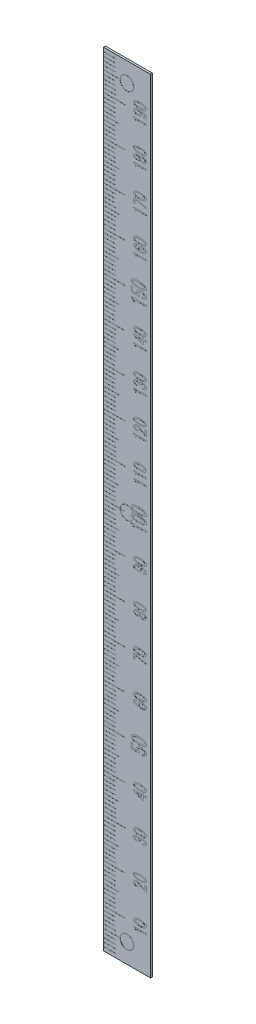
SolidWorks part; units mm, degrees
ref_plane "Front" through (0, 0, 0) normal (0, 0, 1) x (1, 0, 0)
ref_plane "Top" through (0, 0, 0) normal (0, 1, 0) x (1, 0, 0)
ref_plane "Right" through (0, 0, 0) normal (1, 0, 0) x (0, 0, -1)
sketch "Sketch1" plane through (0, 0, 0) normal (0, 0, 1) x (1, 0, 0)
  line L1 (0, 0) -> (0, 200)
  line L2 (0, 0) -> (12, 0)
  line L3 (12, 0) -> (12, 200)
  line L4 (0, 200) -> (12, 200)
  dimension "D1" = 200
  dimension "D2" = 12
extrude "Extrude1" add sketch "Sketch1" along normal blind 0.5
sketch "Sketch2" plane through (0, 0, 0.5) normal (0, 0, 1) x (1, 0, 0)
  line L0 (0, 200) -> (0, 0) construction
  line L1 (0, 0) -> (12, 0) construction
  line L2 (12, 200) -> (0, 200) construction
  circle A0 centre (6, 5) radius 1.75
  circle A1 centre (6, 195) radius 1.75
  circle A2 centre (6, 5) radius 1.65
  circle A3 centre (6, 195) radius 1.65
  circle A4 centre (6, 100) radius 1.75
  circle A5 centre (6, 100) radius 1.65
  dimension "D1" = 6
  dimension "D2" = 6
  dimension "D3" = 5
  dimension "D4" = 5
  dimension "D5" = 3.5
  dimension "D6" = 3.5
  dimension "D7" = 0.1
  dimension "D8" = 2
extrude "Extrude2" cut sketch "Sketch2" against normal blind 0.01
sketch "Sketch3" plane through (0, 0, 0.5) normal (0, 0, 1) x (1, 0, 0)
  line L0 (7.5, 187.4) -> (11, 187.4) construction
  line L1 (7.5, 137.4) -> (11, 137.4) construction
  line L2 (7.5, 137.4) -> (7.5, 140.9) construction
  line L3 (7.5, 140.9) -> (11, 140.9) construction
  line L4 (11, 137.4) -> (11, 140.9) construction
  line L6 (11, 127.4) -> (11, 130.9) construction
  line L7 (11, 117.4) -> (11, 120.9) construction
  line L8 (11, 107.4) -> (11, 110.9) construction
  line L9 (11, 97.2) -> (11, 102.8) construction
  line L10 (11, 88.25) -> (11, 91.75) construction
  line L11 (11, 78.25) -> (11, 81.75) construction
  line L12 (11, 68.25) -> (11, 71.75) construction
  line L13 (11, 58.25) -> (11, 61.75) construction
  line L14 (11, 48) -> (11, 52) construction
  line L15 (11, 38.25) -> (11, 43.5) construction
  line L16 (11, 110) -> (-4.9003, 110) construction
  line L17 (11, 50) -> (-4.9003, 50) construction
  line L18 (11, 28.25) -> (11, 33.5) construction
  line L19 (11, 18.25) -> (11, 23.5) construction
  line L20 (11, 8.25) -> (11, 13.5) construction
  line L21 (11, 100) -> (-4.9003, 100) construction
  line L22 (11, 120) -> (-4.9003, 120) construction
  line L23 (11, 130) -> (-4.9003, 130) construction
  line L24 (11, 140) -> (-4.9003, 140) construction
  line L25 (7.5, 187.4) -> (7.5, 190.9) construction
  line L26 (7.5, 190.9) -> (11, 190.9) construction
  line L27 (11, 187.4) -> (11, 190.9) construction
  line L28 (11, 177.4) -> (11, 180.9) construction
  line L29 (11, 167.4) -> (11, 170.9) construction
  line L30 (11, 157.4) -> (11, 160.9) construction
  line L31 (11, 147.2) -> (11, 152.8) construction
  line L32 (11, 160) -> (-4.9003, 160) construction
  line L33 (11, 150) -> (-4.9003, 150) construction
  line L34 (11, 170) -> (-4.9003, 170) construction
  line L35 (11, 180) -> (-4.9003, 180) construction
  line L36 (11, 190) -> (-4.9003, 190) construction
  line L37 (11, 40) -> (-4.9003, 40) construction
  line L38 (11, 30) -> (-4.9003, 30) construction
  line L39 (11, 20) -> (-4.9003, 20) construction
  line L40 (11, 10) -> (-4.9003, 10) construction
  line L41 (12, 0) -> (12, 200) construction
  text T0 "140" font "ＭＳ ゴシック" height in points 11
  text T1 "130" font "ＭＳ ゴシック" height in points 11
  text T2 "120" font "ＭＳ ゴシック" height in points 11
  text T3 "110" font "ＭＳ ゴシック" height in points 11
  text T4 "100" font "ＭＳ ゴシック" height in points 13
  text T5 "90" font "ＭＳ ゴシック" height in points 11
  text T6 "80" font "ＭＳ ゴシック" height in points 11
  text T7 "70" font "ＭＳ ゴシック" height in points 11
  text T8 "60" font "ＭＳ ゴシック" height in points 11
  text T9 "50" font "ＭＳ ゴシック" height in points 13
  text T10 "40" font "ＭＳ ゴシック" height in points 11
  text T11 "30" font "ＭＳ ゴシック" height in points 11
  text T12 "20" font "ＭＳ ゴシック" height in points 11
  text T13 "10" font "ＭＳ ゴシック" height in points 11
  text T14 "150" font "ＭＳ ゴシック" height in points 13
  text T15 "160" font "ＭＳ ゴシック" height in points 11
  text T16 "170" font "ＭＳ ゴシック" height in points 11
  text T17 "180" font "ＭＳ ゴシック" height in points 11
  text T18 "190" font "ＭＳ ゴシック" height in points 11
  point P19 (11, 100)
  dimension "D1" = 3.5
  dimension "D2" = 2.6
  dimension "D3" = 1
  dimension "D4" = 3.5
  dimension "D8" = 4
  dimension "D9" = 50
  dimension "D10" = 2
  dimension "D11" = 5.6
  dimension "D12" = 2.6
  dimension "D5" = 3.5
  dimension "D13" = 2.6
  dimension "D14" = 2.6
  dimension "D15" = 2
  dimension "D16" = 1.75
  dimension "D17" = 1.75
  dimension "D18" = 1.75
  dimension "D19" = 1.75
  dimension "D6" = 5
  dimension "D7" = 5
extrude "Extrude3" cut sketch "Sketch3" against normal blind 0.01
sketch "Sketch4" plane through (0, 0, 0.5) normal (0, 0, 1) x (1, 0, 0)
  line L5 (12, 200) -> (0, 200) construction
  line L806 (6, 200) -> (6, 0) construction
  line L807 (0, 0) -> (12, 0) construction
  line L808 (3, 1.05) -> (3, 0.95)
  line L809 (0, 0.95) -> (3, 0.95)
  line L810 (0, 1.05) -> (3, 1.05)
  line L811 (0, 1.05) -> (0, 0.95)
  line L812 (3, 2.05) -> (3, 1.95)
  line L813 (0, 1.95) -> (3, 1.95)
  line L814 (0, 2.05) -> (3, 2.05)
  line L815 (0, 2.05) -> (0, 1.95)
  line L816 (3, 3.05) -> (3, 2.95)
  line L817 (0, 2.95) -> (3, 2.95)
  line L818 (0, 3.05) -> (3, 3.05)
  line L819 (0, 3.05) -> (0, 2.95)
  line L820 (3, 4.05) -> (3, 3.95)
  line L821 (0, 3.95) -> (3, 3.95)
  line L822 (0, 4.05) -> (3, 4.05)
  line L823 (0, 4.05) -> (0, 3.95)
  line L824 (3, 6.05) -> (3, 5.95)
  line L825 (0, 5.95) -> (3, 5.95)
  line L826 (0, 6.05) -> (3, 6.05)
  line L827 (0, 6.05) -> (0, 5.95)
  line L828 (3, 7.05) -> (3, 6.95)
  line L829 (0, 6.95) -> (3, 6.95)
  line L830 (0, 7.05) -> (3, 7.05)
  line L831 (0, 7.05) -> (0, 6.95)
  line L832 (3, 8.05) -> (3, 7.95)
  line L833 (0, 7.95) -> (3, 7.95)
  line L834 (0, 8.05) -> (3, 8.05)
  line L835 (3, 9.05) -> (3, 8.95)
  line L836 (0, 8.95) -> (3, 8.95)
  line L837 (0, 9.05) -> (0, 8.95)
  line L838 (0, 9.05) -> (3, 9.05)
  line L839 (4, 4.95) -> (4, 5.05)
  line L840 (0, 5.05) -> (4, 5.05)
  line L841 (0, 4.95) -> (0, 5.05)
  line L842 (0, 4.95) -> (4, 4.95)
  line L843 (0, 8.05) -> (0, 7.95)
  line L844 (0, 9.95) -> (0, 10.05)
  line L845 (5.5, 9.95) -> (0, 9.95)
  line L846 (5.5, 10.05) -> (5.5, 9.95)
  line L847 (0, 10.05) -> (5.5, 10.05)
  line L848 (3, 11.05) -> (3, 10.95)
  line L849 (0, 10.95) -> (3, 10.95)
  line L850 (0, 11.05) -> (3, 11.05)
  line L851 (0, 11.05) -> (0, 10.95)
  line L852 (3, 12.05) -> (3, 11.95)
  line L853 (0, 11.95) -> (3, 11.95)
  line L854 (0, 12.05) -> (3, 12.05)
  line L855 (0, 12.05) -> (0, 11.95)
  line L856 (3, 13.05) -> (3, 12.95)
  line L857 (0, 12.95) -> (3, 12.95)
  line L858 (0, 13.05) -> (3, 13.05)
  line L859 (0, 13.05) -> (0, 12.95)
  line L860 (3, 14.05) -> (3, 13.95)
  line L861 (0, 13.95) -> (3, 13.95)
  line L862 (0, 14.05) -> (3, 14.05)
  line L863 (0, 14.05) -> (0, 13.95)
  line L864 (3, 16.05) -> (3, 15.95)
  line L865 (0, 15.95) -> (3, 15.95)
  line L866 (0, 16.05) -> (3, 16.05)
  line L867 (0, 16.05) -> (0, 15.95)
  line L868 (3, 17.05) -> (3, 16.95)
  line L869 (0, 16.95) -> (3, 16.95)
  line L870 (0, 17.05) -> (3, 17.05)
  line L871 (0, 17.05) -> (0, 16.95)
  line L872 (3, 18.05) -> (3, 17.95)
  line L873 (0, 17.95) -> (3, 17.95)
  line L874 (0, 18.05) -> (3, 18.05)
  line L875 (3, 19.05) -> (3, 18.95)
  line L876 (0, 18.95) -> (3, 18.95)
  line L877 (0, 19.05) -> (0, 18.95)
  line L878 (0, 19.05) -> (3, 19.05)
  line L879 (4, 14.95) -> (4, 15.05)
  line L880 (0, 15.05) -> (4, 15.05)
  line L881 (0, 14.95) -> (0, 15.05)
  line L882 (0, 14.95) -> (4, 14.95)
  line L883 (0, 18.05) -> (0, 17.95)
  line L884 (0, 19.95) -> (0, 20.05)
  line L885 (5.5, 19.95) -> (0, 19.95)
  line L886 (5.5, 20.05) -> (5.5, 19.95)
  line L887 (0, 20.05) -> (5.5, 20.05)
  line L888 (3, 21.05) -> (3, 20.95)
  line L889 (0, 20.95) -> (3, 20.95)
  line L890 (0, 21.05) -> (3, 21.05)
  line L891 (0, 21.05) -> (0, 20.95)
  line L892 (3, 22.05) -> (3, 21.95)
  line L893 (0, 21.95) -> (3, 21.95)
  line L894 (0, 22.05) -> (3, 22.05)
  line L895 (0, 22.05) -> (0, 21.95)
  line L896 (3, 23.05) -> (3, 22.95)
  line L897 (0, 22.95) -> (3, 22.95)
  line L898 (0, 23.05) -> (3, 23.05)
  line L899 (0, 23.05) -> (0, 22.95)
  line L900 (3, 24.05) -> (3, 23.95)
  line L901 (0, 23.95) -> (3, 23.95)
  line L902 (0, 24.05) -> (3, 24.05)
  line L903 (0, 24.05) -> (0, 23.95)
  line L904 (3, 26.05) -> (3, 25.95)
  line L905 (0, 25.95) -> (3, 25.95)
  line L906 (0, 26.05) -> (3, 26.05)
  line L907 (0, 26.05) -> (0, 25.95)
  line L908 (3, 27.05) -> (3, 26.95)
  line L909 (0, 26.95) -> (3, 26.95)
  line L910 (0, 27.05) -> (3, 27.05)
  line L911 (0, 27.05) -> (0, 26.95)
  line L912 (3, 28.05) -> (3, 27.95)
  line L913 (0, 27.95) -> (3, 27.95)
  line L914 (0, 28.05) -> (3, 28.05)
  line L915 (3, 29.05) -> (3, 28.95)
  line L916 (0, 28.95) -> (3, 28.95)
  line L917 (0, 29.05) -> (0, 28.95)
  line L918 (0, 29.05) -> (3, 29.05)
  line L919 (4, 24.95) -> (4, 25.05)
  line L920 (0, 25.05) -> (4, 25.05)
  line L921 (0, 24.95) -> (0, 25.05)
  line L922 (0, 24.95) -> (4, 24.95)
  line L923 (0, 28.05) -> (0, 27.95)
  line L924 (0, 29.95) -> (0, 30.05)
  line L925 (5.5, 29.95) -> (0, 29.95)
  line L926 (5.5, 30.05) -> (5.5, 29.95)
  line L927 (0, 30.05) -> (5.5, 30.05)
  line L928 (3, 31.05) -> (3, 30.95)
  line L929 (0, 30.95) -> (3, 30.95)
  line L930 (0, 31.05) -> (3, 31.05)
  line L931 (0, 31.05) -> (0, 30.95)
  line L932 (3, 32.05) -> (3, 31.95)
  line L933 (0, 31.95) -> (3, 31.95)
  line L934 (0, 32.05) -> (3, 32.05)
  line L935 (0, 32.05) -> (0, 31.95)
  line L936 (3, 33.05) -> (3, 32.95)
  line L937 (0, 32.95) -> (3, 32.95)
  line L938 (0, 33.05) -> (3, 33.05)
  line L939 (0, 33.05) -> (0, 32.95)
  line L940 (3, 34.05) -> (3, 33.95)
  line L941 (0, 33.95) -> (3, 33.95)
  line L942 (0, 34.05) -> (3, 34.05)
  line L943 (0, 34.05) -> (0, 33.95)
  line L944 (3, 36.05) -> (3, 35.95)
  line L945 (0, 35.95) -> (3, 35.95)
  line L946 (0, 36.05) -> (3, 36.05)
  line L947 (0, 36.05) -> (0, 35.95)
  line L948 (3, 37.05) -> (3, 36.95)
  line L949 (0, 36.95) -> (3, 36.95)
  line L950 (0, 37.05) -> (3, 37.05)
  line L951 (0, 37.05) -> (0, 36.95)
  line L952 (3, 38.05) -> (3, 37.95)
  line L953 (0, 37.95) -> (3, 37.95)
  line L954 (0, 38.05) -> (3, 38.05)
  line L955 (3, 39.05) -> (3, 38.95)
  line L956 (0, 38.95) -> (3, 38.95)
  line L957 (0, 39.05) -> (0, 38.95)
  line L958 (0, 39.05) -> (3, 39.05)
  line L959 (4, 34.95) -> (4, 35.05)
  line L960 (0, 35.05) -> (4, 35.05)
  line L961 (0, 34.95) -> (0, 35.05)
  line L962 (0, 34.95) -> (4, 34.95)
  line L963 (0, 38.05) -> (0, 37.95)
  line L964 (0, 39.95) -> (0, 40.05)
  line L965 (5.5, 39.95) -> (0, 39.95)
  line L966 (5.5, 40.05) -> (5.5, 39.95)
  line L967 (0, 40.05) -> (5.5, 40.05)
  line L968 (3, 41.05) -> (3, 40.95)
  line L969 (0, 40.95) -> (3, 40.95)
  line L970 (0, 41.05) -> (3, 41.05)
  line L971 (0, 41.05) -> (0, 40.95)
  line L972 (3, 42.05) -> (3, 41.95)
  line L973 (0, 41.95) -> (3, 41.95)
  line L974 (0, 42.05) -> (3, 42.05)
  line L975 (0, 42.05) -> (0, 41.95)
  line L976 (3, 43.05) -> (3, 42.95)
  line L977 (0, 42.95) -> (3, 42.95)
  line L978 (0, 43.05) -> (3, 43.05)
  line L979 (0, 43.05) -> (0, 42.95)
  line L980 (3, 44.05) -> (3, 43.95)
  line L981 (0, 43.95) -> (3, 43.95)
  line L982 (0, 44.05) -> (3, 44.05)
  line L983 (0, 44.05) -> (0, 43.95)
  line L984 (3, 46.05) -> (3, 45.95)
  line L985 (0, 45.95) -> (3, 45.95)
  line L986 (0, 46.05) -> (3, 46.05)
  line L987 (0, 46.05) -> (0, 45.95)
  line L988 (3, 47.05) -> (3, 46.95)
  line L989 (0, 46.95) -> (3, 46.95)
  line L990 (0, 47.05) -> (3, 47.05)
  line L991 (0, 47.05) -> (0, 46.95)
  line L992 (3, 48.05) -> (3, 47.95)
  line L993 (0, 47.95) -> (3, 47.95)
  line L994 (0, 48.05) -> (3, 48.05)
  line L995 (3, 49.05) -> (3, 48.95)
  line L996 (0, 48.95) -> (3, 48.95)
  line L997 (0, 49.05) -> (0, 48.95)
  line L998 (0, 49.05) -> (3, 49.05)
  line L999 (4, 44.95) -> (4, 45.05)
  line L1000 (0, 45.05) -> (4, 45.05)
  line L1001 (0, 44.95) -> (0, 45.05)
  line L1002 (0, 44.95) -> (4, 44.95)
  line L1003 (0, 48.05) -> (0, 47.95)
  line L1004 (0, 49.95) -> (0, 50.05)
  line L1005 (5.5, 49.95) -> (0, 49.95)
  line L1006 (5.5, 50.05) -> (5.5, 49.95)
  line L1007 (0, 50.05) -> (5.5, 50.05)
  line L1008 (3, 51.05) -> (3, 50.95)
  line L1009 (0, 50.95) -> (3, 50.95)
  line L1010 (0, 51.05) -> (3, 51.05)
  line L1011 (0, 51.05) -> (0, 50.95)
  line L1012 (3, 52.05) -> (3, 51.95)
  line L1013 (0, 51.95) -> (3, 51.95)
  line L1014 (0, 52.05) -> (3, 52.05)
  line L1015 (0, 52.05) -> (0, 51.95)
  line L1016 (3, 53.05) -> (3, 52.95)
  line L1017 (0, 52.95) -> (3, 52.95)
  line L1018 (0, 53.05) -> (3, 53.05)
  line L1019 (0, 53.05) -> (0, 52.95)
  line L1020 (3, 54.05) -> (3, 53.95)
  line L1021 (0, 53.95) -> (3, 53.95)
  line L1022 (0, 54.05) -> (3, 54.05)
  line L1023 (0, 54.05) -> (0, 53.95)
  line L1024 (3, 56.05) -> (3, 55.95)
  line L1025 (0, 55.95) -> (3, 55.95)
  line L1026 (0, 56.05) -> (3, 56.05)
  line L1027 (0, 56.05) -> (0, 55.95)
  line L1028 (3, 57.05) -> (3, 56.95)
  line L1029 (0, 56.95) -> (3, 56.95)
  line L1030 (0, 57.05) -> (3, 57.05)
  line L1031 (0, 57.05) -> (0, 56.95)
  line L1032 (3, 58.05) -> (3, 57.95)
  line L1033 (0, 57.95) -> (3, 57.95)
  line L1034 (0, 58.05) -> (3, 58.05)
  line L1035 (3, 59.05) -> (3, 58.95)
  line L1036 (0, 58.95) -> (3, 58.95)
  line L1037 (0, 59.05) -> (0, 58.95)
  line L1038 (0, 59.05) -> (3, 59.05)
  line L1039 (4, 54.95) -> (4, 55.05)
  line L1040 (0, 55.05) -> (4, 55.05)
  line L1041 (0, 54.95) -> (0, 55.05)
  line L1042 (0, 54.95) -> (4, 54.95)
  line L1043 (0, 58.05) -> (0, 57.95)
  line L1044 (0, 59.95) -> (0, 60.05)
  line L1045 (5.5, 59.95) -> (0, 59.95)
  line L1046 (5.5, 60.05) -> (5.5, 59.95)
  line L1047 (0, 60.05) -> (5.5, 60.05)
  line L1048 (3, 61.05) -> (3, 60.95)
  line L1049 (0, 60.95) -> (3, 60.95)
  line L1050 (0, 61.05) -> (3, 61.05)
  line L1051 (0, 61.05) -> (0, 60.95)
  line L1052 (3, 62.05) -> (3, 61.95)
  line L1053 (0, 61.95) -> (3, 61.95)
  line L1054 (0, 62.05) -> (3, 62.05)
  line L1055 (0, 62.05) -> (0, 61.95)
  line L1056 (3, 63.05) -> (3, 62.95)
  line L1057 (0, 62.95) -> (3, 62.95)
  line L1058 (0, 63.05) -> (3, 63.05)
  line L1059 (0, 63.05) -> (0, 62.95)
  line L1060 (3, 64.05) -> (3, 63.95)
  line L1061 (0, 63.95) -> (3, 63.95)
  line L1062 (0, 64.05) -> (3, 64.05)
  line L1063 (0, 64.05) -> (0, 63.95)
  line L1064 (3, 66.05) -> (3, 65.95)
  line L1065 (0, 65.95) -> (3, 65.95)
  line L1066 (0, 66.05) -> (3, 66.05)
  line L1067 (0, 66.05) -> (0, 65.95)
  line L1068 (3, 67.05) -> (3, 66.95)
  line L1069 (0, 66.95) -> (3, 66.95)
  line L1070 (0, 67.05) -> (3, 67.05)
  line L1071 (0, 67.05) -> (0, 66.95)
  line L1072 (3, 68.05) -> (3, 67.95)
  line L1073 (0, 67.95) -> (3, 67.95)
  line L1074 (0, 68.05) -> (3, 68.05)
  line L1075 (3, 69.05) -> (3, 68.95)
  line L1076 (0, 68.95) -> (3, 68.95)
  line L1077 (0, 69.05) -> (0, 68.95)
  line L1078 (0, 69.05) -> (3, 69.05)
  line L1079 (4, 64.95) -> (4, 65.05)
  line L1080 (0, 65.05) -> (4, 65.05)
  line L1081 (0, 64.95) -> (0, 65.05)
  line L1082 (0, 64.95) -> (4, 64.95)
  line L1083 (0, 68.05) -> (0, 67.95)
  line L1084 (0, 69.95) -> (0, 70.05)
  line L1085 (5.5, 69.95) -> (0, 69.95)
  line L1086 (5.5, 70.05) -> (5.5, 69.95)
  line L1087 (0, 70.05) -> (5.5, 70.05)
  line L1088 (3, 71.05) -> (3, 70.95)
  line L1089 (0, 70.95) -> (3, 70.95)
  line L1090 (0, 71.05) -> (3, 71.05)
  line L1091 (0, 71.05) -> (0, 70.95)
  line L1092 (3, 72.05) -> (3, 71.95)
  line L1093 (0, 71.95) -> (3, 71.95)
  line L1094 (0, 72.05) -> (3, 72.05)
  line L1095 (0, 72.05) -> (0, 71.95)
  line L1096 (3, 73.05) -> (3, 72.95)
  line L1097 (0, 72.95) -> (3, 72.95)
  line L1098 (0, 73.05) -> (3, 73.05)
  line L1099 (0, 73.05) -> (0, 72.95)
  line L1100 (3, 74.05) -> (3, 73.95)
  line L1101 (0, 73.95) -> (3, 73.95)
  line L1102 (0, 74.05) -> (3, 74.05)
  line L1103 (0, 74.05) -> (0, 73.95)
  line L1104 (3, 76.05) -> (3, 75.95)
  line L1105 (0, 75.95) -> (3, 75.95)
  line L1106 (0, 76.05) -> (3, 76.05)
  line L1107 (0, 76.05) -> (0, 75.95)
  line L1108 (3, 77.05) -> (3, 76.95)
  line L1109 (0, 76.95) -> (3, 76.95)
  line L1110 (0, 77.05) -> (3, 77.05)
  line L1111 (0, 77.05) -> (0, 76.95)
  line L1112 (3, 78.05) -> (3, 77.95)
  line L1113 (0, 77.95) -> (3, 77.95)
  line L1114 (0, 78.05) -> (3, 78.05)
  line L1115 (3, 79.05) -> (3, 78.95)
  line L1116 (0, 78.95) -> (3, 78.95)
  line L1117 (0, 79.05) -> (0, 78.95)
  line L1118 (0, 79.05) -> (3, 79.05)
  line L1119 (4, 74.95) -> (4, 75.05)
  line L1120 (0, 75.05) -> (4, 75.05)
  line L1121 (0, 74.95) -> (0, 75.05)
  line L1122 (0, 74.95) -> (4, 74.95)
  line L1123 (0, 78.05) -> (0, 77.95)
  line L1124 (0, 79.95) -> (0, 80.05)
  line L1125 (5.5, 79.95) -> (0, 79.95)
  line L1126 (5.5, 80.05) -> (5.5, 79.95)
  line L1127 (0, 80.05) -> (5.5, 80.05)
  line L1128 (3, 81.05) -> (3, 80.95)
  line L1129 (0, 80.95) -> (3, 80.95)
  line L1130 (0, 81.05) -> (3, 81.05)
  line L1131 (0, 81.05) -> (0, 80.95)
  line L1132 (3, 82.05) -> (3, 81.95)
  line L1133 (0, 81.95) -> (3, 81.95)
  line L1134 (0, 82.05) -> (3, 82.05)
  line L1135 (0, 82.05) -> (0, 81.95)
  line L1136 (3, 83.05) -> (3, 82.95)
  line L1137 (0, 82.95) -> (3, 82.95)
  line L1138 (0, 83.05) -> (3, 83.05)
  line L1139 (0, 83.05) -> (0, 82.95)
  line L1140 (3, 84.05) -> (3, 83.95)
  line L1141 (0, 83.95) -> (3, 83.95)
  line L1142 (0, 84.05) -> (3, 84.05)
  line L1143 (0, 84.05) -> (0, 83.95)
  line L1144 (3, 86.05) -> (3, 85.95)
  line L1145 (0, 85.95) -> (3, 85.95)
  line L1146 (0, 86.05) -> (3, 86.05)
  line L1147 (0, 86.05) -> (0, 85.95)
  line L1148 (3, 87.05) -> (3, 86.95)
  line L1149 (0, 86.95) -> (3, 86.95)
  line L1150 (0, 87.05) -> (3, 87.05)
  line L1151 (0, 87.05) -> (0, 86.95)
  line L1152 (3, 88.05) -> (3, 87.95)
  line L1153 (0, 87.95) -> (3, 87.95)
  line L1154 (0, 88.05) -> (3, 88.05)
  line L1155 (3, 89.05) -> (3, 88.95)
  line L1156 (0, 88.95) -> (3, 88.95)
  line L1157 (0, 89.05) -> (0, 88.95)
  line L1158 (0, 89.05) -> (3, 89.05)
  line L1159 (4, 84.95) -> (4, 85.05)
  line L1160 (0, 85.05) -> (4, 85.05)
  line L1161 (0, 84.95) -> (0, 85.05)
  line L1162 (0, 84.95) -> (4, 84.95)
  line L1163 (0, 88.05) -> (0, 87.95)
  line L1164 (0, 89.95) -> (0, 90.05)
  line L1165 (5.5, 89.95) -> (0, 89.95)
  line L1166 (5.5, 90.05) -> (5.5, 89.95)
  line L1167 (0, 90.05) -> (5.5, 90.05)
  line L1168 (3, 91.05) -> (3, 90.95)
  line L1169 (0, 90.95) -> (3, 90.95)
  line L1170 (0, 91.05) -> (3, 91.05)
  line L1171 (0, 91.05) -> (0, 90.95)
  line L1172 (3, 92.05) -> (3, 91.95)
  line L1173 (0, 91.95) -> (3, 91.95)
  line L1174 (0, 92.05) -> (3, 92.05)
  line L1175 (0, 92.05) -> (0, 91.95)
  line L1176 (3, 93.05) -> (3, 92.95)
  line L1177 (0, 92.95) -> (3, 92.95)
  line L1178 (0, 93.05) -> (3, 93.05)
  line L1179 (0, 93.05) -> (0, 92.95)
  line L1180 (3, 94.05) -> (3, 93.95)
  line L1181 (0, 93.95) -> (3, 93.95)
  line L1182 (0, 94.05) -> (3, 94.05)
  line L1183 (0, 94.05) -> (0, 93.95)
  line L1184 (3, 96.05) -> (3, 95.95)
  line L1185 (0, 95.95) -> (3, 95.95)
  line L1186 (0, 96.05) -> (3, 96.05)
  line L1187 (0, 96.05) -> (0, 95.95)
  line L1188 (3, 97.05) -> (3, 96.95)
  line L1189 (0, 96.95) -> (3, 96.95)
  line L1190 (0, 97.05) -> (3, 97.05)
  line L1191 (0, 97.05) -> (0, 96.95)
  line L1192 (3, 98.05) -> (3, 97.95)
  line L1193 (0, 97.95) -> (3, 97.95)
  line L1194 (0, 98.05) -> (3, 98.05)
  line L1195 (3, 99.05) -> (3, 98.95)
  line L1196 (0, 98.95) -> (3, 98.95)
  line L1197 (0, 99.05) -> (0, 98.95)
  line L1198 (0, 99.05) -> (3, 99.05)
  line L1199 (4, 94.95) -> (4, 95.05)
  line L1200 (0, 95.05) -> (4, 95.05)
  line L1201 (0, 94.95) -> (0, 95.05)
  line L1202 (0, 94.95) -> (4, 94.95)
  line L1203 (0, 98.05) -> (0, 97.95)
  line L1204 (0, 99.95) -> (0, 100.05)
  line L1205 (5.5, 99.95) -> (0, 99.95)
  line L1206 (5.5, 100.05) -> (5.5, 99.95)
  line L1207 (0, 100.05) -> (5.5, 100.05)
  line L1208 (3, 101.05) -> (3, 100.95)
  line L1209 (0, 100.95) -> (3, 100.95)
  line L1210 (0, 101.05) -> (3, 101.05)
  line L1211 (0, 101.05) -> (0, 100.95)
  line L1212 (3, 102.05) -> (3, 101.95)
  line L1213 (0, 101.95) -> (3, 101.95)
  line L1214 (0, 102.05) -> (3, 102.05)
  line L1215 (0, 102.05) -> (0, 101.95)
  line L1216 (3, 103.05) -> (3, 102.95)
  line L1217 (0, 102.95) -> (3, 102.95)
  line L1218 (0, 103.05) -> (3, 103.05)
  line L1219 (0, 103.05) -> (0, 102.95)
  line L1220 (3, 104.05) -> (3, 103.95)
  line L1221 (0, 103.95) -> (3, 103.95)
  line L1222 (0, 104.05) -> (3, 104.05)
  line L1223 (0, 104.05) -> (0, 103.95)
  line L1224 (3, 106.05) -> (3, 105.95)
  line L1225 (0, 105.95) -> (3, 105.95)
  line L1226 (0, 106.05) -> (3, 106.05)
  line L1227 (0, 106.05) -> (0, 105.95)
  line L1228 (3, 107.05) -> (3, 106.95)
  line L1229 (0, 106.95) -> (3, 106.95)
  line L1230 (0, 107.05) -> (3, 107.05)
  line L1231 (0, 107.05) -> (0, 106.95)
  line L1232 (3, 108.05) -> (3, 107.95)
  line L1233 (0, 107.95) -> (3, 107.95)
  line L1234 (0, 108.05) -> (3, 108.05)
  line L1235 (3, 109.05) -> (3, 108.95)
  line L1236 (0, 108.95) -> (3, 108.95)
  line L1237 (0, 109.05) -> (0, 108.95)
  line L1238 (0, 109.05) -> (3, 109.05)
  line L1239 (4, 104.95) -> (4, 105.05)
  line L1240 (0, 105.05) -> (4, 105.05)
  line L1241 (0, 104.95) -> (0, 105.05)
  line L1242 (0, 104.95) -> (4, 104.95)
  line L1243 (0, 108.05) -> (0, 107.95)
  line L1244 (0, 109.95) -> (0, 110.05)
  line L1245 (5.5, 109.95) -> (0, 109.95)
  line L1246 (5.5, 110.05) -> (5.5, 109.95)
  line L1247 (0, 110.05) -> (5.5, 110.05)
  line L1248 (3, 111.05) -> (3, 110.95)
  line L1249 (0, 110.95) -> (3, 110.95)
  line L1250 (0, 111.05) -> (3, 111.05)
  line L1251 (0, 111.05) -> (0, 110.95)
  line L1252 (3, 112.05) -> (3, 111.95)
  line L1253 (0, 111.95) -> (3, 111.95)
  line L1254 (0, 112.05) -> (3, 112.05)
  line L1255 (0, 112.05) -> (0, 111.95)
  line L1256 (3, 113.05) -> (3, 112.95)
  line L1257 (0, 112.95) -> (3, 112.95)
  line L1258 (0, 113.05) -> (3, 113.05)
  line L1259 (0, 113.05) -> (0, 112.95)
  line L1260 (3, 114.05) -> (3, 113.95)
  line L1261 (0, 113.95) -> (3, 113.95)
  line L1262 (0, 114.05) -> (3, 114.05)
  line L1263 (0, 114.05) -> (0, 113.95)
  line L1264 (3, 116.05) -> (3, 115.95)
  line L1265 (0, 115.95) -> (3, 115.95)
  line L1266 (0, 116.05) -> (3, 116.05)
  line L1267 (0, 116.05) -> (0, 115.95)
  line L1268 (3, 117.05) -> (3, 116.95)
  line L1269 (0, 116.95) -> (3, 116.95)
  line L1270 (0, 117.05) -> (3, 117.05)
  line L1271 (0, 117.05) -> (0, 116.95)
  line L1272 (3, 118.05) -> (3, 117.95)
  line L1273 (0, 117.95) -> (3, 117.95)
  line L1274 (0, 118.05) -> (3, 118.05)
  line L1275 (3, 119.05) -> (3, 118.95)
  line L1276 (0, 118.95) -> (3, 118.95)
  line L1277 (0, 119.05) -> (0, 118.95)
  line L1278 (0, 119.05) -> (3, 119.05)
  line L1279 (4, 114.95) -> (4, 115.05)
  line L1280 (0, 115.05) -> (4, 115.05)
  line L1281 (0, 114.95) -> (0, 115.05)
  line L1282 (0, 114.95) -> (4, 114.95)
  line L1283 (0, 118.05) -> (0, 117.95)
  line L1284 (0, 119.95) -> (0, 120.05)
  line L1285 (5.5, 119.95) -> (0, 119.95)
  line L1286 (5.5, 120.05) -> (5.5, 119.95)
  line L1287 (0, 120.05) -> (5.5, 120.05)
  line L1288 (3, 121.05) -> (3, 120.95)
  line L1289 (0, 120.95) -> (3, 120.95)
  line L1290 (0, 121.05) -> (3, 121.05)
  line L1291 (0, 121.05) -> (0, 120.95)
  line L1292 (3, 122.05) -> (3, 121.95)
  line L1293 (0, 121.95) -> (3, 121.95)
  line L1294 (0, 122.05) -> (3, 122.05)
  line L1295 (0, 122.05) -> (0, 121.95)
  line L1296 (3, 123.05) -> (3, 122.95)
  line L1297 (0, 122.95) -> (3, 122.95)
  line L1298 (0, 123.05) -> (3, 123.05)
  line L1299 (0, 123.05) -> (0, 122.95)
  line L1300 (3, 124.05) -> (3, 123.95)
  line L1301 (0, 123.95) -> (3, 123.95)
  line L1302 (0, 124.05) -> (3, 124.05)
  line L1303 (0, 124.05) -> (0, 123.95)
  line L1304 (3, 126.05) -> (3, 125.95)
  line L1305 (0, 125.95) -> (3, 125.95)
  line L1306 (0, 126.05) -> (3, 126.05)
  line L1307 (0, 126.05) -> (0, 125.95)
  line L1308 (3, 127.05) -> (3, 126.95)
  line L1309 (0, 126.95) -> (3, 126.95)
  line L1310 (0, 127.05) -> (3, 127.05)
  line L1311 (0, 127.05) -> (0, 126.95)
  line L1312 (3, 128.05) -> (3, 127.95)
  line L1313 (0, 127.95) -> (3, 127.95)
  line L1314 (0, 128.05) -> (3, 128.05)
  line L1315 (3, 129.05) -> (3, 128.95)
  line L1316 (0, 128.95) -> (3, 128.95)
  line L1317 (0, 129.05) -> (0, 128.95)
  line L1318 (0, 129.05) -> (3, 129.05)
  line L1319 (4, 124.95) -> (4, 125.05)
  line L1320 (0, 125.05) -> (4, 125.05)
  line L1321 (0, 124.95) -> (0, 125.05)
  line L1322 (0, 124.95) -> (4, 124.95)
  line L1323 (0, 128.05) -> (0, 127.95)
  line L1324 (0, 129.95) -> (0, 130.05)
  line L1325 (5.5, 129.95) -> (0, 129.95)
  line L1326 (5.5, 130.05) -> (5.5, 129.95)
  line L1327 (0, 130.05) -> (5.5, 130.05)
  line L1328 (3, 131.05) -> (3, 130.95)
  line L1329 (0, 130.95) -> (3, 130.95)
  line L1330 (0, 131.05) -> (3, 131.05)
  line L1331 (0, 131.05) -> (0, 130.95)
  line L1332 (3, 132.05) -> (3, 131.95)
  line L1333 (0, 131.95) -> (3, 131.95)
  line L1334 (0, 132.05) -> (3, 132.05)
  line L1335 (0, 132.05) -> (0, 131.95)
  line L1336 (3, 133.05) -> (3, 132.95)
  line L1337 (0, 132.95) -> (3, 132.95)
  line L1338 (0, 133.05) -> (3, 133.05)
  line L1339 (0, 133.05) -> (0, 132.95)
  line L1340 (3, 134.05) -> (3, 133.95)
  line L1341 (0, 133.95) -> (3, 133.95)
  line L1342 (0, 134.05) -> (3, 134.05)
  line L1343 (0, 134.05) -> (0, 133.95)
  line L1344 (3, 136.05) -> (3, 135.95)
  line L1345 (0, 135.95) -> (3, 135.95)
  line L1346 (0, 136.05) -> (3, 136.05)
  line L1347 (0, 136.05) -> (0, 135.95)
  line L1348 (3, 137.05) -> (3, 136.95)
  line L1349 (0, 136.95) -> (3, 136.95)
  line L1350 (0, 137.05) -> (3, 137.05)
  line L1351 (0, 137.05) -> (0, 136.95)
  line L1352 (3, 138.05) -> (3, 137.95)
  line L1353 (0, 137.95) -> (3, 137.95)
  line L1354 (0, 138.05) -> (3, 138.05)
  line L1355 (3, 139.05) -> (3, 138.95)
  line L1356 (0, 138.95) -> (3, 138.95)
  line L1357 (0, 139.05) -> (0, 138.95)
  line L1358 (0, 139.05) -> (3, 139.05)
  line L1359 (4, 134.95) -> (4, 135.05)
  line L1360 (0, 135.05) -> (4, 135.05)
  line L1361 (0, 134.95) -> (0, 135.05)
  line L1362 (0, 134.95) -> (4, 134.95)
  line L1363 (0, 138.05) -> (0, 137.95)
  line L1364 (0, 139.95) -> (0, 140.05)
  line L1365 (5.5, 139.95) -> (0, 139.95)
  line L1366 (5.5, 140.05) -> (5.5, 139.95)
  line L1367 (0, 140.05) -> (5.5, 140.05)
  line L1368 (3, 141.05) -> (3, 140.95)
  line L1369 (0, 140.95) -> (3, 140.95)
  line L1370 (0, 141.05) -> (3, 141.05)
  line L1371 (0, 141.05) -> (0, 140.95)
  line L1372 (3, 142.05) -> (3, 141.95)
  line L1373 (0, 141.95) -> (3, 141.95)
  line L1374 (0, 142.05) -> (3, 142.05)
  line L1375 (0, 142.05) -> (0, 141.95)
  line L1376 (3, 143.05) -> (3, 142.95)
  line L1377 (0, 142.95) -> (3, 142.95)
  line L1378 (0, 143.05) -> (3, 143.05)
  line L1379 (0, 143.05) -> (0, 142.95)
  line L1380 (3, 144.05) -> (3, 143.95)
  line L1381 (0, 143.95) -> (3, 143.95)
  line L1382 (0, 144.05) -> (3, 144.05)
  line L1383 (0, 144.05) -> (0, 143.95)
  line L1384 (3, 146.05) -> (3, 145.95)
  line L1385 (0, 145.95) -> (3, 145.95)
  line L1386 (0, 146.05) -> (3, 146.05)
  line L1387 (0, 146.05) -> (0, 145.95)
  line L1388 (3, 147.05) -> (3, 146.95)
  line L1389 (0, 146.95) -> (3, 146.95)
  line L1390 (0, 147.05) -> (3, 147.05)
  line L1391 (0, 147.05) -> (0, 146.95)
  line L1392 (3, 148.05) -> (3, 147.95)
  line L1393 (0, 147.95) -> (3, 147.95)
  line L1394 (0, 148.05) -> (3, 148.05)
  line L1395 (3, 149.05) -> (3, 148.95)
  line L1396 (0, 148.95) -> (3, 148.95)
  line L1397 (0, 149.05) -> (0, 148.95)
  line L1398 (0, 149.05) -> (3, 149.05)
  line L1399 (4, 144.95) -> (4, 145.05)
  line L1400 (0, 145.05) -> (4, 145.05)
  line L1401 (0, 144.95) -> (0, 145.05)
  line L1402 (0, 144.95) -> (4, 144.95)
  line L1403 (0, 148.05) -> (0, 147.95)
  line L1404 (3, 151.05) -> (3, 150.95)
  line L1405 (0, 150.95) -> (3, 150.95)
  line L1406 (0, 151.05) -> (3, 151.05)
  line L1407 (0, 151.05) -> (0, 150.95)
  line L1408 (3, 152.05) -> (3, 151.95)
  line L1409 (0, 151.95) -> (3, 151.95)
  line L1410 (0, 152.05) -> (3, 152.05)
  line L1411 (0, 152.05) -> (0, 151.95)
  line L1412 (3, 153.05) -> (3, 152.95)
  line L1413 (0, 152.95) -> (3, 152.95)
  line L1414 (0, 153.05) -> (3, 153.05)
  line L1415 (0, 153.05) -> (0, 152.95)
  line L1416 (3, 154.05) -> (3, 153.95)
  line L1417 (0, 153.95) -> (3, 153.95)
  line L1418 (0, 154.05) -> (3, 154.05)
  line L1419 (0, 154.05) -> (0, 153.95)
  line L1420 (3, 156.05) -> (3, 155.95)
  line L1421 (0, 155.95) -> (3, 155.95)
  line L1422 (0, 156.05) -> (3, 156.05)
  line L1423 (0, 156.05) -> (0, 155.95)
  line L1424 (3, 157.05) -> (3, 156.95)
  line L1425 (0, 156.95) -> (3, 156.95)
  line L1426 (0, 157.05) -> (3, 157.05)
  line L1427 (0, 157.05) -> (0, 156.95)
  line L1428 (3, 158.05) -> (3, 157.95)
  line L1429 (0, 157.95) -> (3, 157.95)
  line L1430 (0, 158.05) -> (3, 158.05)
  line L1431 (3, 159.05) -> (3, 158.95)
  line L1432 (0, 158.95) -> (3, 158.95)
  line L1433 (0, 159.05) -> (0, 158.95)
  line L1434 (0, 159.05) -> (3, 159.05)
  line L1435 (4, 154.95) -> (4, 155.05)
  line L1436 (0, 155.05) -> (4, 155.05)
  line L1437 (0, 154.95) -> (0, 155.05)
  line L1438 (0, 154.95) -> (4, 154.95)
  line L1439 (0, 158.05) -> (0, 157.95)
  line L1440 (0, 149.95) -> (0, 150.05)
  line L1441 (5.5, 149.95) -> (0, 149.95)
  line L1442 (5.5, 150.05) -> (5.5, 149.95)
  line L1443 (0, 150.05) -> (5.5, 150.05)
  line L1444 (3, 161.05) -> (3, 160.95)
  line L1445 (0, 160.95) -> (3, 160.95)
  line L1446 (0, 161.05) -> (3, 161.05)
  line L1447 (0, 161.05) -> (0, 160.95)
  line L1448 (3, 162.05) -> (3, 161.95)
  line L1449 (0, 161.95) -> (3, 161.95)
  line L1450 (0, 162.05) -> (3, 162.05)
  line L1451 (0, 162.05) -> (0, 161.95)
  line L1452 (3, 163.05) -> (3, 162.95)
  line L1453 (0, 162.95) -> (3, 162.95)
  line L1454 (0, 163.05) -> (3, 163.05)
  line L1455 (0, 163.05) -> (0, 162.95)
  line L1456 (3, 164.05) -> (3, 163.95)
  line L1457 (0, 163.95) -> (3, 163.95)
  line L1458 (0, 164.05) -> (3, 164.05)
  line L1459 (0, 164.05) -> (0, 163.95)
  line L1460 (3, 166.05) -> (3, 165.95)
  line L1461 (0, 165.95) -> (3, 165.95)
  line L1462 (0, 166.05) -> (3, 166.05)
  line L1463 (0, 166.05) -> (0, 165.95)
  line L1464 (3, 167.05) -> (3, 166.95)
  line L1465 (0, 166.95) -> (3, 166.95)
  line L1466 (0, 167.05) -> (3, 167.05)
  line L1467 (0, 167.05) -> (0, 166.95)
  line L1468 (3, 168.05) -> (3, 167.95)
  line L1469 (0, 167.95) -> (3, 167.95)
  line L1470 (0, 168.05) -> (3, 168.05)
  line L1471 (3, 169.05) -> (3, 168.95)
  line L1472 (0, 168.95) -> (3, 168.95)
  line L1473 (0, 169.05) -> (0, 168.95)
  line L1474 (0, 169.05) -> (3, 169.05)
  line L1475 (4, 164.95) -> (4, 165.05)
  line L1476 (0, 165.05) -> (4, 165.05)
  line L1477 (0, 164.95) -> (0, 165.05)
  line L1478 (0, 164.95) -> (4, 164.95)
  line L1479 (0, 168.05) -> (0, 167.95)
  line L1480 (0, 159.95) -> (0, 160.05)
  line L1481 (5.5, 159.95) -> (0, 159.95)
  line L1482 (5.5, 160.05) -> (5.5, 159.95)
  line L1483 (0, 160.05) -> (5.5, 160.05)
  line L1484 (3, 171.05) -> (3, 170.95)
  line L1485 (0, 170.95) -> (3, 170.95)
  line L1486 (0, 171.05) -> (3, 171.05)
  line L1487 (0, 171.05) -> (0, 170.95)
  line L1488 (3, 172.05) -> (3, 171.95)
  line L1489 (0, 171.95) -> (3, 171.95)
  line L1490 (0, 172.05) -> (3, 172.05)
  line L1491 (0, 172.05) -> (0, 171.95)
  line L1492 (3, 173.05) -> (3, 172.95)
  line L1493 (0, 172.95) -> (3, 172.95)
  line L1494 (0, 173.05) -> (3, 173.05)
  line L1495 (0, 173.05) -> (0, 172.95)
  line L1496 (3, 174.05) -> (3, 173.95)
  line L1497 (0, 173.95) -> (3, 173.95)
  line L1498 (0, 174.05) -> (3, 174.05)
  line L1499 (0, 174.05) -> (0, 173.95)
  line L1500 (3, 176.05) -> (3, 175.95)
  line L1501 (0, 175.95) -> (3, 175.95)
  line L1502 (0, 176.05) -> (3, 176.05)
  line L1503 (0, 176.05) -> (0, 175.95)
  line L1504 (3, 177.05) -> (3, 176.95)
  line L1505 (0, 176.95) -> (3, 176.95)
  line L1506 (0, 177.05) -> (3, 177.05)
  line L1507 (0, 177.05) -> (0, 176.95)
  line L1508 (3, 178.05) -> (3, 177.95)
  line L1509 (0, 177.95) -> (3, 177.95)
  line L1510 (0, 178.05) -> (3, 178.05)
  line L1511 (3, 179.05) -> (3, 178.95)
  line L1512 (0, 178.95) -> (3, 178.95)
  line L1513 (0, 179.05) -> (0, 178.95)
  line L1514 (0, 179.05) -> (3, 179.05)
  line L1515 (4, 174.95) -> (4, 175.05)
  line L1516 (0, 175.05) -> (4, 175.05)
  line L1517 (0, 174.95) -> (0, 175.05)
  line L1518 (0, 174.95) -> (4, 174.95)
  line L1519 (0, 178.05) -> (0, 177.95)
  line L1520 (0, 169.95) -> (0, 170.05)
  line L1521 (5.5, 169.95) -> (0, 169.95)
  line L1522 (5.5, 170.05) -> (5.5, 169.95)
  line L1523 (0, 170.05) -> (5.5, 170.05)
  line L1524 (3, 181.05) -> (3, 180.95)
  line L1525 (0, 180.95) -> (3, 180.95)
  line L1526 (0, 181.05) -> (3, 181.05)
  line L1527 (0, 181.05) -> (0, 180.95)
  line L1528 (3, 182.05) -> (3, 181.95)
  line L1529 (0, 181.95) -> (3, 181.95)
  line L1530 (0, 182.05) -> (3, 182.05)
  line L1531 (0, 182.05) -> (0, 181.95)
  line L1532 (3, 183.05) -> (3, 182.95)
  line L1533 (0, 182.95) -> (3, 182.95)
  line L1534 (0, 183.05) -> (3, 183.05)
  line L1535 (0, 183.05) -> (0, 182.95)
  line L1536 (3, 184.05) -> (3, 183.95)
  line L1537 (0, 183.95) -> (3, 183.95)
  line L1538 (0, 184.05) -> (3, 184.05)
  line L1539 (0, 184.05) -> (0, 183.95)
  line L1540 (3, 186.05) -> (3, 185.95)
  line L1541 (0, 185.95) -> (3, 185.95)
  line L1542 (0, 186.05) -> (3, 186.05)
  line L1543 (0, 186.05) -> (0, 185.95)
  line L1544 (3, 187.05) -> (3, 186.95)
  line L1545 (0, 186.95) -> (3, 186.95)
  line L1546 (0, 187.05) -> (3, 187.05)
  line L1547 (0, 187.05) -> (0, 186.95)
  line L1548 (3, 188.05) -> (3, 187.95)
  line L1549 (0, 187.95) -> (3, 187.95)
  line L1550 (0, 188.05) -> (3, 188.05)
  line L1551 (3, 189.05) -> (3, 188.95)
  line L1552 (0, 188.95) -> (3, 188.95)
  line L1553 (0, 189.05) -> (0, 188.95)
  line L1554 (0, 189.05) -> (3, 189.05)
  line L1555 (4, 184.95) -> (4, 185.05)
  line L1556 (0, 185.05) -> (4, 185.05)
  line L1557 (0, 184.95) -> (0, 185.05)
  line L1558 (0, 184.95) -> (4, 184.95)
  line L1559 (0, 188.05) -> (0, 187.95)
  line L1560 (3, 191.05) -> (3, 190.95)
  line L1561 (0, 190.95) -> (3, 190.95)
  line L1562 (0, 191.05) -> (3, 191.05)
  line L1563 (0, 191.05) -> (0, 190.95)
  line L1564 (3, 192.05) -> (3, 191.95)
  line L1565 (0, 191.95) -> (3, 191.95)
  line L1566 (0, 192.05) -> (3, 192.05)
  line L1567 (0, 192.05) -> (0, 191.95)
  line L1568 (3, 193.05) -> (3, 192.95)
  line L1569 (0, 192.95) -> (3, 192.95)
  line L1570 (0, 193.05) -> (3, 193.05)
  line L1571 (0, 193.05) -> (0, 192.95)
  line L1572 (3, 194.05) -> (3, 193.95)
  line L1573 (0, 193.95) -> (3, 193.95)
  line L1574 (0, 194.05) -> (3, 194.05)
  line L1575 (0, 194.05) -> (0, 193.95)
  line L1576 (0, 179.95) -> (0, 180.05)
  line L1577 (5.5, 179.95) -> (0, 179.95)
  line L1578 (5.5, 180.05) -> (5.5, 179.95)
  line L1579 (0, 180.05) -> (5.5, 180.05)
  line L1580 (3, 196.05) -> (3, 195.95)
  line L1581 (0, 195.95) -> (3, 195.95)
  line L1582 (0, 196.05) -> (3, 196.05)
  line L1583 (0, 196.05) -> (0, 195.95)
  line L1584 (3, 197.05) -> (3, 196.95)
  line L1585 (0, 196.95) -> (3, 196.95)
  line L1586 (0, 197.05) -> (3, 197.05)
  line L1587 (0, 197.05) -> (0, 196.95)
  line L1588 (3, 198.05) -> (3, 197.95)
  line L1589 (0, 197.95) -> (3, 197.95)
  line L1590 (0, 198.05) -> (3, 198.05)
  line L1591 (3, 199.05) -> (3, 198.95)
  line L1592 (0, 198.95) -> (3, 198.95)
  line L1593 (0, 199.05) -> (0, 198.95)
  line L1594 (0, 199.05) -> (3, 199.05)
  line L1595 (4, 194.95) -> (4, 195.05)
  line L1596 (0, 195.05) -> (4, 195.05)
  line L1597 (0, 194.95) -> (0, 195.05)
  line L1598 (0, 194.95) -> (4, 194.95)
  line L1599 (0, 198.05) -> (0, 197.95)
  line L1600 (0, 189.95) -> (0, 190.05)
  line L1601 (5.5, 189.95) -> (0, 189.95)
  line L1602 (5.5, 190.05) -> (5.5, 189.95)
  line L1603 (0, 190.05) -> (5.5, 190.05)
extrude "Extrude4" cut sketch "Sketch4" against normal blind 0.01
move or copy body "Body-Move/Copy2" bodies to move or copy 105 copy no translate (-12, 0, 0)
